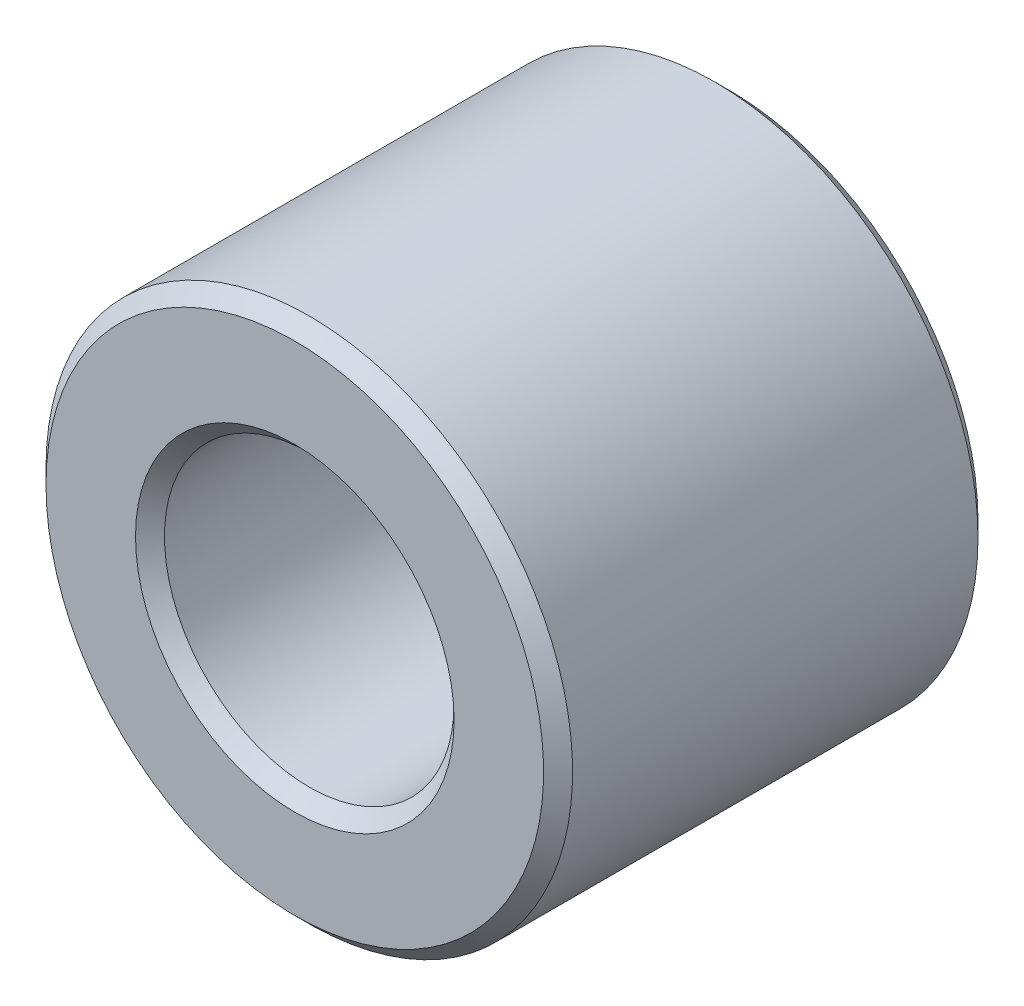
SolidWorks part; units mm, degrees
ref_plane "Front Plane" through (0, 0, 0) normal (0, 0, 1) x (1, 0, 0)
ref_plane "Top Plane" through (0, 0, 0) normal (0, 1, 0) x (1, 0, 0)
ref_plane "Right Plane" through (0, 0, 0) normal (1, 0, 0) x (0, 0, -1)
sketch "Sketch1" plane through (0, 0, 0) normal (0, 0, 1) x (1, 0, 0)
  circle A0 centre (0, 0) radius 22
  circle A1 centre (0, 0) radius 40
  dimension "D1" = 44
  dimension "D2" = 80
extrude "Boss-Extrude1" add sketch "Sketch1" along normal mid plane 66
chamfer "Chamfer1" distance 2.2 angle 45 4 edges at (22, 0, -33) (40, 0, -33) (22, 0, 33) (40, 0, 33)
